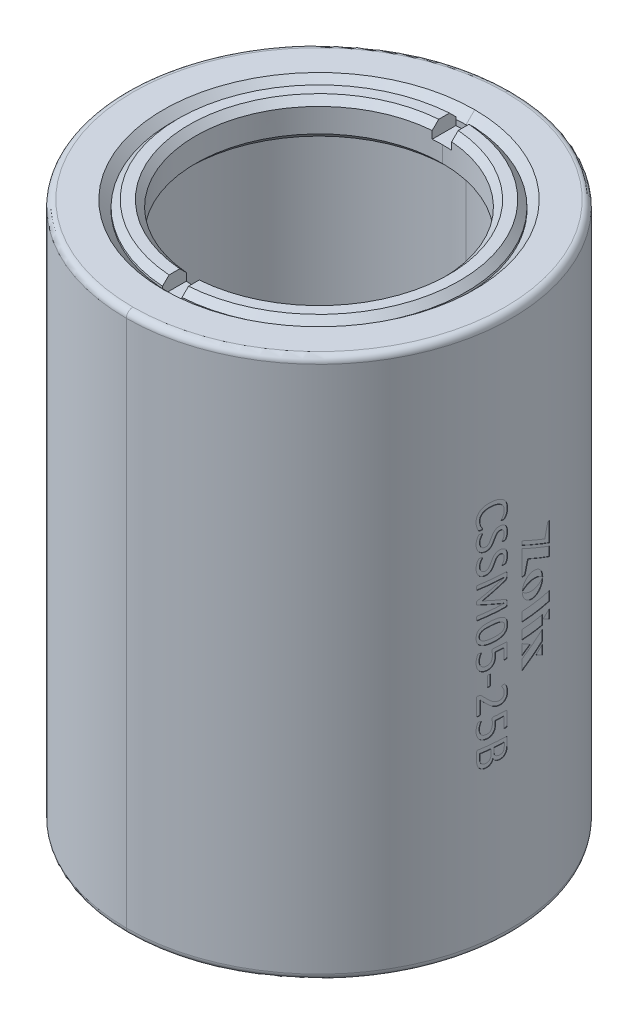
SolidWorks part; units mm, degrees
ref_plane "前视基准面" through (0, 0, 0) normal (0, 0, 1) x (1, 0, 0)
ref_plane "上视基准面" through (0, 0, 0) normal (0, 1, 0) x (1, 0, 0)
ref_plane "右视基准面" through (0, 0, 0) normal (1, 0, 0) x (0, 0, -1)
imported_body "SM05卡环.STEP-1-solid1"
imported_body "SM05卡环.STEP-2-solid1"
imported_body "CSSM05-25B-1.STEP-1-solid1"
sketch "草图1" plane through (0, 0, 0) normal (1, 0, 0) x (0, 0, -1)
  line L0 (-8.9, 26.5082) -> (-8.9, 2.1082) construction
  point P3 (0.5, 14.3082)
  point P4 (-8.9, 14.3082)
  line B0 (0.5, 14.0957) -> (0.5, 14.5208)
  line B1 (0.5, 14.5208) -> (1.9984, 14.5208)
  line B2 (1.9984, 14.5208) -> (1.9984, 14.0957)
  line B3 (1.9984, 14.0957) -> (0.5, 14.0957)
  line B4 (1.5827, 13.2294) -> (1.5827, 12.7398)
  line B5 (1.5827, 12.7398) -> (0.5, 12.1452)
  line B6 (0.5, 12.1452) -> (0.5, 12.6255)
  line B7 (0.5, 12.6255) -> (1.5827, 13.2294)
  line B8 (1.5827, 12.6201) -> (1.5827, 12.1762)
  line B9 (1.5827, 12.1762) -> (1.2035, 12.3981)
  line B10 (1.2035, 12.3981) -> (1.5827, 12.6201)
  line B11 (0.9157, 12.9793) -> (0.5, 13.232)
  line B12 (0.5, 13.232) -> (0.5, 12.7533)
  line B13 (0.5, 12.7533) -> (0.9157, 12.9793)
  line B14 (1.0488, 15.5014) -> (1.1109, 15.4994)
  line B15 (1.1109, 15.4994) -> (1.1696, 15.4928)
  line B16 (1.1696, 15.4928) -> (1.2248, 15.4826)
  line B17 (1.2248, 15.4826) -> (1.2766, 15.4694)
  line B18 (1.2766, 15.4694) -> (1.3247, 15.4541)
  line B19 (1.3247, 15.4541) -> (1.369, 15.4367)
  line B20 (1.369, 15.4367) -> (1.4096, 15.4182)
  line B21 (1.4096, 15.4182) -> (1.4463, 15.3993)
  line B22 (1.4463, 15.3993) -> (1.4789, 15.38)
  line B23 (1.4789, 15.38) -> (1.5076, 15.3614)
  line B24 (1.5076, 15.3614) -> (1.532, 15.344)
  line B25 (1.532, 15.344) -> (1.5523, 15.3283)
  line B26 (1.5523, 15.3283) -> (1.5682, 15.3152)
  line B27 (1.5682, 15.3152) -> (1.5799, 15.3051)
  line B28 (1.5799, 15.3051) -> (1.5869, 15.2982)
  line B29 (1.5869, 15.2982) -> (1.5895, 15.2958)
  line B30 (1.5895, 15.2958) -> (1.5895, 15.2971)
  line B31 (1.5895, 15.2971) -> (1.5867, 15.3523)
  line B32 (1.5867, 15.3523) -> (1.5785, 15.406)
  line B33 (1.5785, 15.406) -> (1.5652, 15.4578)
  line B34 (1.5652, 15.4578) -> (1.547, 15.5076)
  line B35 (1.547, 15.5076) -> (1.5242, 15.5548)
  line B36 (1.5242, 15.5548) -> (1.4972, 15.5994)
  line B37 (1.4972, 15.5994) -> (1.466, 15.641)
  line B38 (1.466, 15.641) -> (1.4311, 15.6794)
  line B39 (1.4311, 15.6794) -> (1.3927, 15.7142)
  line B40 (1.3927, 15.7142) -> (1.3511, 15.7455)
  line B41 (1.3511, 15.7455) -> (1.3065, 15.7726)
  line B42 (1.3065, 15.7726) -> (1.2593, 15.7953)
  line B43 (1.2593, 15.7953) -> (1.2095, 15.8134)
  line B44 (1.2095, 15.8134) -> (1.1578, 15.8266)
  line B45 (1.1578, 15.8266) -> (1.1041, 15.8349)
  line B46 (1.1041, 15.8349) -> (1.0488, 15.8378)
  line B47 (1.0488, 15.8378) -> (0.9935, 15.8349)
  line B48 (0.9935, 15.8349) -> (0.9399, 15.8266)
  line B49 (0.9399, 15.8266) -> (0.888, 15.8134)
  line B50 (0.888, 15.8134) -> (0.8383, 15.7953)
  line B51 (0.8383, 15.7953) -> (0.7911, 15.7726)
  line B52 (0.7911, 15.7726) -> (0.7465, 15.7455)
  line B53 (0.7465, 15.7455) -> (0.7048, 15.7142)
  line B54 (0.7048, 15.7142) -> (0.6664, 15.6794)
  line B55 (0.6664, 15.6794) -> (0.6314, 15.641)
  line B56 (0.6314, 15.641) -> (0.6004, 15.5994)
  line B57 (0.6004, 15.5994) -> (0.5732, 15.5548)
  line B58 (0.5732, 15.5548) -> (0.5505, 15.5076)
  line B59 (0.5505, 15.5076) -> (0.5324, 15.4578)
  line B60 (0.5324, 15.4578) -> (0.5189, 15.406)
  line B61 (0.5189, 15.406) -> (0.5109, 15.3523)
  line B62 (0.5109, 15.3523) -> (0.5081, 15.2971)
  line B63 (0.5081, 15.2971) -> (0.5081, 15.2958)
  line B64 (0.5081, 15.2958) -> (0.5105, 15.298)
  line B65 (0.5105, 15.298) -> (0.5177, 15.3045)
  line B66 (0.5177, 15.3045) -> (0.5295, 15.3147)
  line B67 (0.5295, 15.3147) -> (0.5453, 15.328)
  line B68 (0.5453, 15.328) -> (0.5658, 15.3435)
  line B69 (0.5658, 15.3435) -> (0.5904, 15.3609)
  line B70 (0.5904, 15.3609) -> (0.619, 15.3795)
  line B71 (0.619, 15.3795) -> (0.6518, 15.3986)
  line B72 (0.6518, 15.3986) -> (0.6886, 15.4179)
  line B73 (0.6886, 15.4179) -> (0.7291, 15.4365)
  line B74 (0.7291, 15.4365) -> (0.7735, 15.4539)
  line B75 (0.7735, 15.4539) -> (0.8214, 15.4694)
  line B76 (0.8214, 15.4694) -> (0.8731, 15.4825)
  line B77 (0.8731, 15.4825) -> (0.9283, 15.4926)
  line B78 (0.9283, 15.4926) -> (0.9869, 15.4994)
  line B79 (0.9869, 15.4994) -> (1.0488, 15.5014)
  line B80 (1.5895, 15.2858) -> (1.5869, 15.2833)
  line B81 (1.5869, 15.2833) -> (1.5799, 15.2766)
  line B82 (1.5799, 15.2766) -> (1.5682, 15.2665)
  line B83 (1.5682, 15.2665) -> (1.5523, 15.2532)
  line B84 (1.5523, 15.2532) -> (1.532, 15.2375)
  line B85 (1.532, 15.2375) -> (1.5076, 15.2201)
  line B86 (1.5076, 15.2201) -> (1.4789, 15.2017)
  line B87 (1.4789, 15.2017) -> (1.4463, 15.1826)
  line B88 (1.4463, 15.1826) -> (1.4096, 15.1635)
  line B89 (1.4096, 15.1635) -> (1.369, 15.1448)
  line B90 (1.369, 15.1448) -> (1.3247, 15.1276)
  line B91 (1.3247, 15.1276) -> (1.2766, 15.1121)
  line B92 (1.2766, 15.1121) -> (1.2248, 15.099)
  line B93 (1.2248, 15.099) -> (1.1696, 15.089)
  line B94 (1.1696, 15.089) -> (1.1109, 15.0825)
  line B95 (1.1109, 15.0825) -> (1.0488, 15.0801)
  line B96 (1.0488, 15.0801) -> (0.9869, 15.0825)
  line B97 (0.9869, 15.0825) -> (0.9283, 15.089)
  line B98 (0.9283, 15.089) -> (0.8731, 15.099)
  line B99 (0.8731, 15.099) -> (0.8214, 15.1123)
  line B100 (0.8214, 15.1123) -> (0.7735, 15.1278)
  line B101 (0.7735, 15.1278) -> (0.7291, 15.1452)
  line B102 (0.7291, 15.1452) -> (0.6886, 15.1636)
  line B103 (0.6886, 15.1636) -> (0.6518, 15.1829)
  line B104 (0.6518, 15.1829) -> (0.619, 15.202)
  line B105 (0.619, 15.202) -> (0.5904, 15.2206)
  line B106 (0.5904, 15.2206) -> (0.5658, 15.238)
  line B107 (0.5658, 15.238) -> (0.5453, 15.2537)
  line B108 (0.5453, 15.2537) -> (0.5295, 15.2668)
  line B109 (0.5295, 15.2668) -> (0.5177, 15.277)
  line B110 (0.5177, 15.277) -> (0.5105, 15.2835)
  line B111 (0.5105, 15.2835) -> (0.5081, 15.2858)
  line B112 (0.5081, 15.2858) -> (0.511, 15.2308)
  line B113 (0.511, 15.2308) -> (0.5195, 15.1774)
  line B114 (0.5195, 15.1774) -> (0.5329, 15.1259)
  line B115 (0.5329, 15.1259) -> (0.5512, 15.0766)
  line B116 (0.5512, 15.0766) -> (0.5739, 15.0296)
  line B117 (0.5739, 15.0296) -> (0.6011, 14.9853)
  line B118 (0.6011, 14.9853) -> (0.6321, 14.944)
  line B119 (0.6321, 14.944) -> (0.6669, 14.9059)
  line B120 (0.6669, 14.9059) -> (0.7053, 14.8715)
  line B121 (0.7053, 14.8715) -> (0.7467, 14.8406)
  line B122 (0.7467, 14.8406) -> (0.7913, 14.8138)
  line B123 (0.7913, 14.8138) -> (0.8384, 14.7912)
  line B124 (0.8384, 14.7912) -> (0.8881, 14.7733)
  line B125 (0.8881, 14.7733) -> (0.9399, 14.76)
  line B126 (0.9399, 14.76) -> (0.9935, 14.7518)
  line B127 (0.9935, 14.7518) -> (1.0488, 14.7492)
  line B128 (1.0488, 14.7492) -> (1.1038, 14.7518)
  line B129 (1.1038, 14.7518) -> (1.1572, 14.76)
  line B130 (1.1572, 14.76) -> (1.2089, 14.7733)
  line B131 (1.2089, 14.7733) -> (1.2584, 14.7912)
  line B132 (1.2584, 14.7912) -> (1.3054, 14.8138)
  line B133 (1.3054, 14.8138) -> (1.3498, 14.8406)
  line B134 (1.3498, 14.8406) -> (1.3912, 14.8715)
  line B135 (1.3912, 14.8715) -> (1.4296, 14.9059)
  line B136 (1.4296, 14.9059) -> (1.4645, 14.944)
  line B137 (1.4645, 14.944) -> (1.4955, 14.9853)
  line B138 (1.4955, 14.9853) -> (1.5227, 15.0296)
  line B139 (1.5227, 15.0296) -> (1.5457, 15.0766)
  line B140 (1.5457, 15.0766) -> (1.564, 15.1259)
  line B141 (1.564, 15.1259) -> (1.5777, 15.1774)
  line B142 (1.5777, 15.1774) -> (1.5862, 15.2308)
  line B143 (1.5862, 15.2308) -> (1.5895, 15.2858)
  line B144 (1.9997, 15.8714) -> (1.9997, 16.2924)
  line B145 (1.9997, 16.2924) -> (0.5, 17.031)
  line B146 (0.5, 17.031) -> (0.5, 15.8888)
  line B147 (0.5, 15.8888) -> (0.6438, 15.8888)
  line B148 (0.6438, 15.8888) -> (0.7985, 16.4595)
  line B149 (0.7985, 16.4595) -> (1.9997, 15.8714)
  line B150 (1.9997, 16.4244) -> (0.5, 17.1628)
  line B151 (0.5, 17.1628) -> (0.5, 17.3473)
  line B152 (0.5, 17.3473) -> (1.7078, 16.7486)
  line B153 (1.7078, 16.7486) -> (1.8827, 17.3309)
  line B154 (1.8827, 17.3309) -> (1.9997, 17.3309)
  line B155 (1.9997, 17.3309) -> (1.9997, 16.4244)
  line B156 (0.5, 13.3787) -> (0.5, 13.8025)
  line B157 (0.5, 13.8025) -> (1.5827, 13.8025)
  line B158 (1.5827, 13.8025) -> (1.5827, 13.3787)
  line B159 (1.5827, 13.3787) -> (0.5, 13.3787)
  line B160 (1.9984, 13.8118) -> (1.6096, 13.5994)
  line B161 (1.6096, 13.5994) -> (1.9984, 13.3774)
  line B162 (1.9984, 13.3774) -> (1.9984, 13.8118)
  dimension "D1" = 0.5
sketch_block_instance "1.5mmLogo字体-1"
sketch_block "1.5mmLogo字体" parameters "D1"=0.0031, "D2"=0.8502, "D3"=0.2341
wrap "包覆1" sketch "草图1" wrap type deboss source sketch "草图1" thickness 0.02 parameters "D1"=0.02
sketch "草图2" plane through (0, 0, 0) normal (1, 0, 0) x (0, 0, -1)
  line L0 (-1.5003, 20.3082) -> (-1.5003, 8.3082) construction
  line L1 (0.4997, 17.031) -> (0.4997, 15.8888) construction
  line L2 (-8.9, 26.5082) -> (-8.9, 2.1082) construction
  text T0 "CSSM05-25B" font "Calibri" height 1.3
  point P4 (-1.5003, 14.3082)
  point P7 (-8.9, 14.3082)
  dimension "D1" = 12
  dimension "D2" = 2
wrap "包覆2" sketch "草图2" wrap type deboss source sketch "草图2" thickness 0.02 parameters "D1"=0.02
